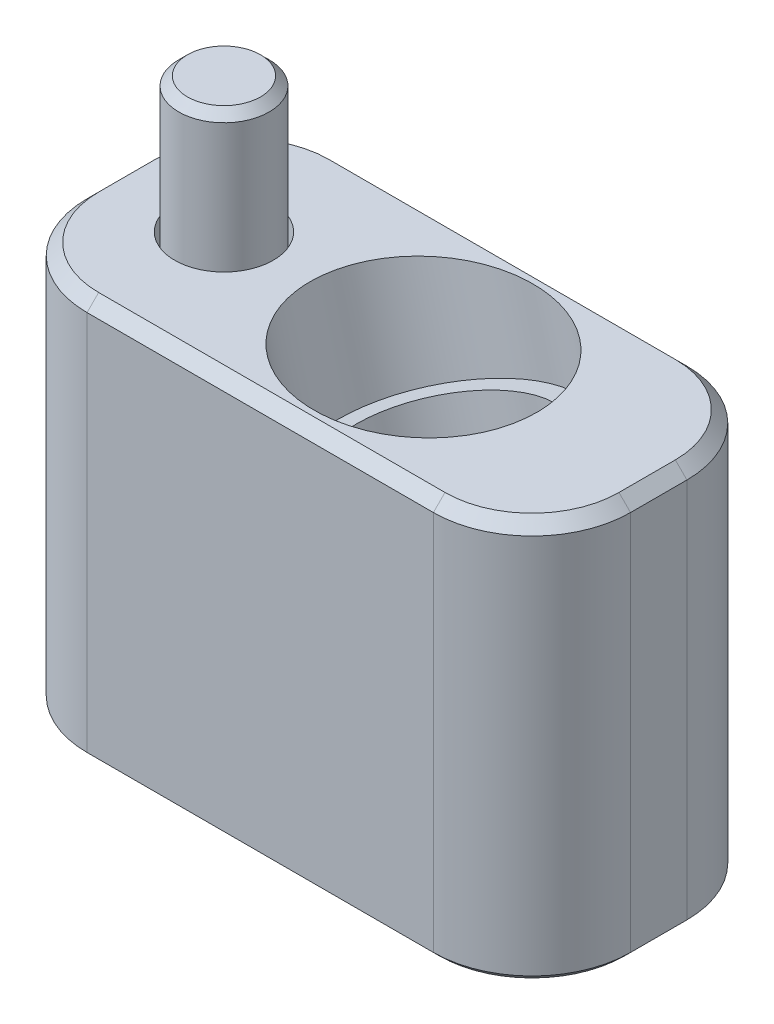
SolidWorks part; units mm, degrees
other "<SHCS31-18L1.50>-<Chamfer2>"
ref_plane "Front Plane" through (0, 0, 0) normal (0, 0, 1) x (1, 0, 0)
ref_plane "Top Plane" through (0, 0, 0) normal (0, 1, 0) x (1, 0, 0)
ref_plane "Right Plane" through (0, 0, 0) normal (1, 0, 0) x (0, 0, -1)
sketch "Sketch1" plane through (0, 0, 0) normal (0, 1, 0) x (1, 0, 0)
  line L1 (11.9761, -11.1061) -> (-18.3642, -11.1062)
  line L2 (20.6121, -2.4701) -> (20.6121, 2.4702)
  line L3 (11.9761, 11.1061) -> (-18.3642, 11.1061)
  line L4 (-27.0002, -2.4702) -> (-27.0002, 2.4701)
  line L5 (20.6121, -11.1061) -> (-27.0002, 11.1061) construction
  line L6 (20.6121, 11.1062) -> (-27.0002, -11.1062) construction
  arc A0 (11.9761, 11.1061) -> (20.6121, 2.4702) centre (11.9761, 2.4702) cw
  arc A1 (20.6121, -2.4701) -> (11.9761, -11.1061) centre (11.9761, -2.4701) cw
  arc A2 (-18.3642, -11.1062) -> (-27.0002, -2.4702) centre (-18.3642, -2.4702) cw
  arc A3 (-27.0002, 2.4701) -> (-18.3642, 11.1061) centre (-18.3642, 2.4701) cw
  point P0 (-3.194, 0)
  dimension "D3" = 8.636
  dimension "D1" = 22.2123
  dimension "D2" = 47.6123
  dimension "D4" = 27.0002
extrude "Boss-Extrude1" add sketch "Sketch1" against normal blind 34.8996
sketch "Sketch2" plane through (0, 0, 0) normal (0, 0, 1) x (1, 0, 0)
  line L0 (0, 0) -> (1.865, -6.9603) construction
  line L1 (-18.3642, 0) -> (11.9761, 0) construction
  line L2 (-2.7645, 10.3172) -> (11.8393, -44.1847)
  line L3 (0, -12.2168) -> (0, 12.2168) construction
  line L4 (-5.8842, -8.7818) -> (-7.4605, -9.2041)
  line L5 (-7.4605, -9.2041) -> (-12.0263, 7.8355)
  line L6 (-2.7645, 10.3172) -> (-12.0263, 7.8355)
  line L7 (-5.8842, -8.7818) -> (3.602, -44.1847)
  line L8 (3.602, -44.1847) -> (11.8393, -44.1847)
  dimension "D1" = 15
  dimension "D2" = 15.9131
  dimension "D3" = 6.9596
  dimension "D4" = 19.177
revolve "Cut-Revolve1" cut sketch "Sketch2" angle 360 about L0
chamfer "Chamfer1" distance 1.016 angle 45 8 edges at (-3.194, 0, -11.1061) (-24.4708, 0, -8.5767) (18.0827, 0, -8.5767) (-27.0002, 0, 0) (20.6121, 0, 0) (-24.4708, 0, 8.5767) (18.0827, 0, 8.5767) (-3.194, 0, 11.1062)
hole_wizard "CBORE for 5/16 Socket Head Cap Screw1" positions "Sketch3" profile "Sketch4" counterbore size "5/16" standard "ANSI Inch"
sketch "Sketch3" plane through (0, -34.8996, 0) normal (0, 1, 0) x (1, 0, 0)
  line L1 (-27.0002, 2.4701) -> (-27.0002, -2.4702) construction
  point P0 (-17.4752, 0)
  dimension "D1" = 9.525
sketch "Sketch4" plane through (-17.4752, -34.8996, 0) normal (1, 0, 0) x (0, 0, -1)
  line L0 (0, 0) -> (0, 34.8996)
  line L1 (0, 34.8996) -> (4.318, 34.8996)
  line L3 (4.318, 34.8996) -> (4.318, 8.636)
  line L4 (4.318, 8.636) -> (6.35, 8.636)
  line L5 (6.35, 8.636) -> (6.35, 0)
  line L7 (6.35, 0) -> (0, 0)
  line L11 (0, -6.35) -> (0, 107.95) construction
  dimension "Thru Hole Dia." = 8.636
  dimension "Thru Hole Depth" = 34.8996
  dimension "C'Bore Dia." = 12.7
  dimension "C'Bore Depth" = 8.636
hole_wizard "3/8-16 Tapped Hole1" positions "Sketch7" profile "Sketch8" tap size "3/8-16" standard "ANSI Inch"
sketch "Sketch7" plane through (0, -26.2636, 0) normal (0, -1, 0) x (-1, 0, 0)
  point P0 (17.4752, 0)
sketch "Sketch8" plane through (-17.4752, -26.2636, 0) normal (1, 0, 0) x (0, 0, -1)
  line L0 (0, 0) -> (0, 18.3501)
  line L1 (0, 18.3501) -> (4.3307, 15.748)
  line L2 (4.3307, 15.748) -> (4.3307, 0)
  line L5 (4.3307, 0) -> (0, 0)
  line L10 (0, 18.3501) -> (-4.3307, 15.748) construction
  line L11 (0, -6.35) -> (0, 107.95) construction
  dimension "Tap Drill Dia." = 8.6614
  dimension "Tap Drill Depth" = 15.748
  dimension "Drill Angle" = 118
chamfer "Chamfer2" distance 0.508 angle 45 8 edges at (-3.194, -34.8996, -11.1061) (-24.4708, -34.8996, -8.5767) (18.0827, -34.8996, -8.5767) (-27.0002, -34.8996, 0) (20.6121, -34.8996, 0) (-24.4708, -34.8996, 8.5767) (18.0827, -34.8996, 8.5767) (-3.194, -34.8996, 11.1062)
inserted part "SHCS31-18L1.50"
move or copy body "Body-Move/Copy2" placed by mates yes
